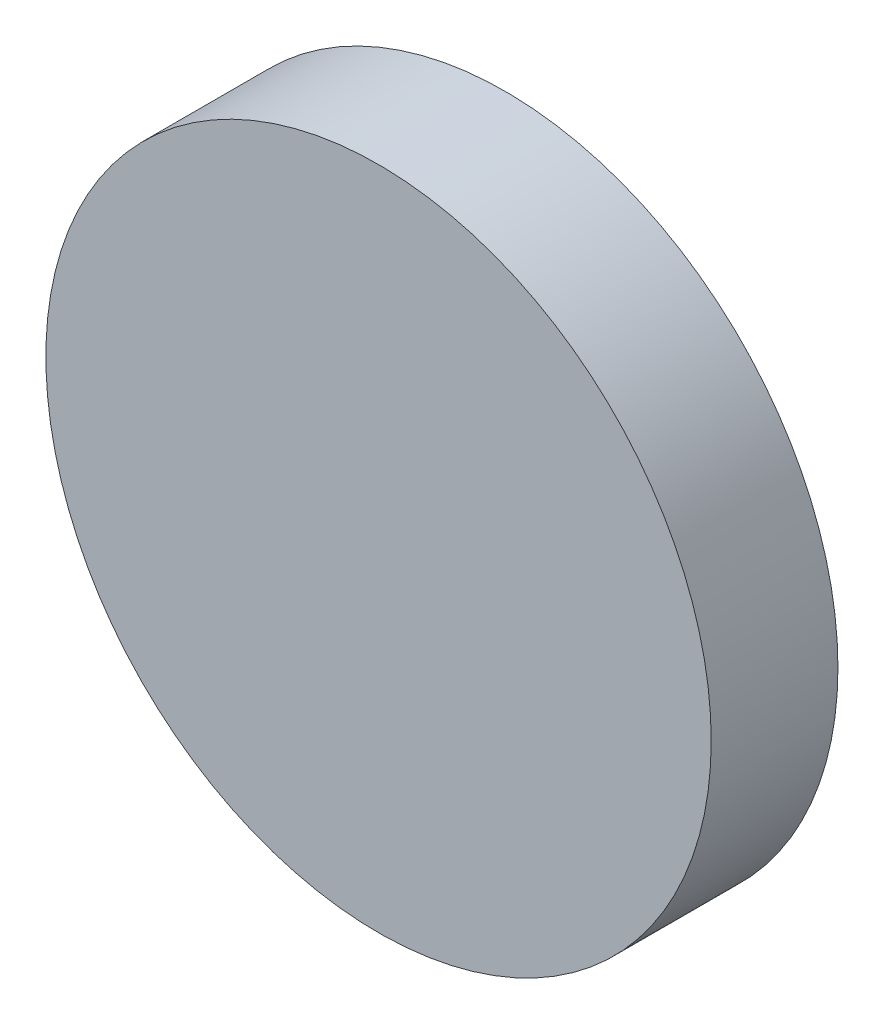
SolidWorks part; units mm, degrees
ref_plane "Front Plane" through (0, 0, 0) normal (0, 0, 1) x (1, 0, 0)
ref_plane "Top Plane" through (0, 0, 0) normal (0, 1, 0) x (1, 0, 0)
ref_plane "Right Plane" through (0, 0, 0) normal (1, 0, 0) x (0, 0, -1)
sketch "Sketch1" plane through (0, 0, 0) normal (0, 0, 1) x (1, 0, 0)
  circle A0 centre (0, 0) radius 52.5
  dimension "D1" = 105
extrude "Boss-Extrude1" add sketch "Sketch1" along normal blind 20
